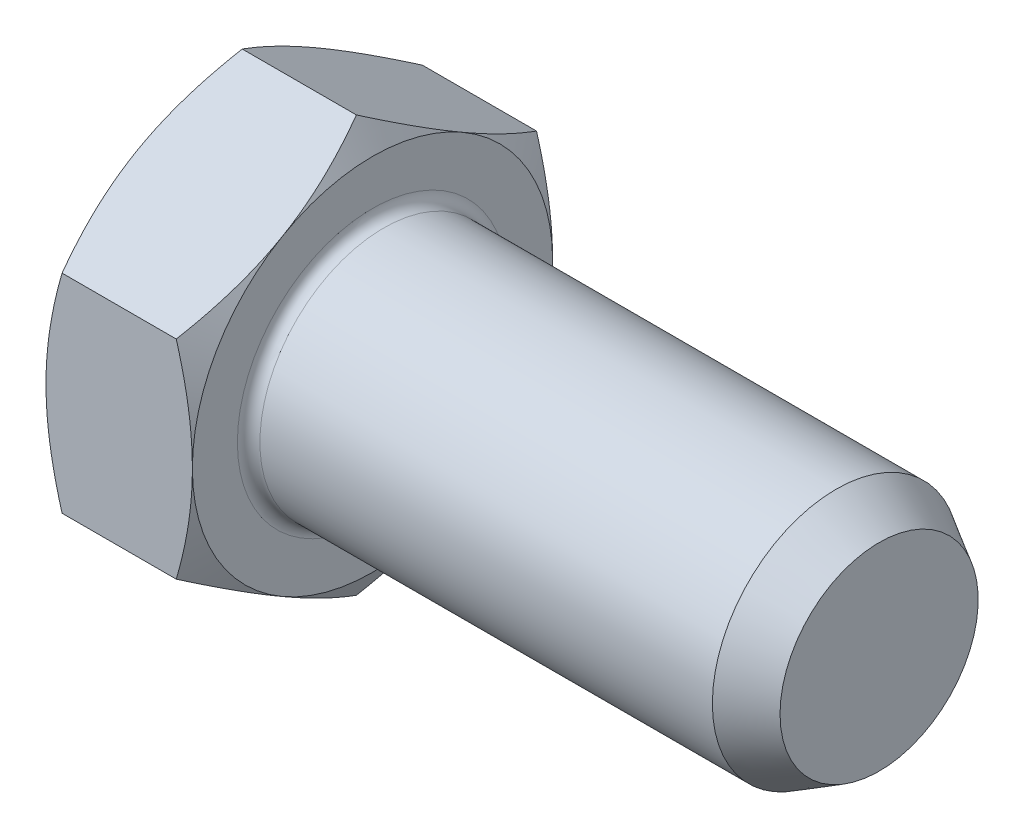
SolidWorks part; units mm, degrees
ref_plane "Front" through (0, 0, 0) normal (0, 0, 1) x (1, 0, 0)
ref_plane "Top" through (0, 0, 0) normal (0, 1, 0) x (1, 0, 0)
ref_plane "Right" through (0, 0, 0) normal (1, 0, 0) x (0, 0, -1)
sketch "Sketch1" plane through (0, 0, 0) normal (0, 0, 1) x (1, 0, 0)
  line L0 (0, 0) -> (0, 1.4)
  line L1 (0, 1.4) -> (1.3, 1.4)
  line L2 (1.3, 1.4) -> (1.3, 1.1)
  line L4 (1.3, 1.1) -> (5.8, 1.1)
  line L5 (5.8, 1.1) -> (5.8, 0)
  line L6 (5.8, 0) -> (0, 0)
  line L7 (13.1079, 0) -> (-2.2203, 0) construction
  dimension "da" = 2.8
  dimension "d" = 2.2
  dimension "k" = 1.3
  dimension "l" = 4.5
revolve "Revolve1" add sketch "Sketch1" angle 360 about L7
sketch "Sketch2" plane through (0, 0, 0) normal (-1, 0, 0) x (0, 0, 1)
  line L1 (1.6, -0.9238) -> (1.6, 0.9238)
  line L2 (1.6, 0.9238) -> (0, 1.8475)
  line L3 (0, 1.8475) -> (-1.6, 0.9238)
  line L4 (-1.6, 0.9238) -> (-1.6, -0.9238)
  line L5 (-1.6, -0.9238) -> (0, -1.8475)
  line L6 (0, -1.8475) -> (1.6, -0.9238)
  circle A0 centre (0, 0) radius 1.6 construction
  dimension "s" = 3.2
extrude "Extrude1" add sketch "Sketch2" against normal blind 1.3
sketch "Sketch3" plane through (0, 0, 0) normal (0, 1, 0) x (1, 0, 0)
  line L0 (-0.9238, 0) -> (0.65, 2.7258)
  line L1 (0.65, 2.7258) -> (1.3, 1.6)
  line L2 (0, 0) -> (-2.2444, 0) construction
  line L4 (1.3, 1.6) -> (1.3, 3.2258)
  line L5 (1.3, 3.2258) -> (-1.0238, 3.2258)
  line L6 (-0.9238, 0) -> (-1.0238, 0)
  line L7 (-1.0238, 0) -> (-1.0238, 3.2258)
  dimension "D1" = 60
  dimension "D2" = 0.5
  dimension "D3" = 0.1
  dimension "D4" = 60
revolve "Cut-Revolve2" cut sketch "Sketch3" angle 360 about L2
sketch "Sketch4" plane through (0, 0, 0) normal (0, 0, 1) x (1, 0, 0)
  line L0 (0, 0) -> (1.9538, 0) construction
  line L1 (-0.2, 0) -> (-0.2, 1.28)
  line L2 (-0.2, 1.28) -> (0.4, 1.28)
  line L3 (0.4, 1.28) -> (0.4, 0)
  line L4 (1.3, 1.4) -> (1.3, 1.1) construction
  line L5 (1.3, 1.4) -> (1.3, 1.8049) construction
  line L6 (0.4, 0) -> (-0.2, 0)
  dimension "D1" = 0.2
  dimension "D2" = 2.56
  dimension "k'" = 0.9
revolve "Cut-Revolve3" cut sketch "Sketch4" angle 360 about L0
chamfer "Chamfer1" distance 0.22 angle 60 1 edges at (5.8, 0, -1.1)
sketch "Sketch6" plane through (0, 0, 0) normal (0, 0, 1) x (1, 0, 0)
  line L0 (2.0155, 0.815) -> (1.5445, 0.815)
  line L1 (1.5445, 0.815) -> (1.38, 1.1)
  line L2 (2.0155, 0.815) -> (2.18, 1.1)
  line L3 (1.38, 1.1) -> (1.38, 1.35)
  line L4 (2.18, 1.1) -> (2.18, 1.35)
  line L5 (1.38, 1.35) -> (2.18, 1.35)
  line L6 (1.78, 0.815) -> (1.78, 0) construction
  line L7 (0, 0) -> (7.3035, 0) construction
  dimension "D1" = 2.2
  dimension "D2" = 60
  dimension "D3" = 0.25
  dimension "threadstart" = 1.78
  dimension "minordia" = 1.63
  dimension "advance" = 0.8
revolve "ThreadSchematic" [suppressed] cut sketch "Sketch6" angle 360 about L7
pattern_linear "ThdSchPat" [suppressed] count 6 spacing 0.8 along (-1, 0, 0)
sketch "Sketch5" plane through (0, 0, 0) normal (0, 0, 1) x (1, 0, 0)
  line L1 (5.8, 1.1) -> (5.8, 0) construction
  line L3 (3.5, -1.1) -> (4, -1.1) construction
  line L4 (0, 0) -> (6.648, 0) construction
  line L5 (5.8, 0) -> (4, -1.1)
  line L6 (5.8, 0) -> (6, 0)
  line L7 (6, 0) -> (6, -1.3)
  line L8 (6, -1.3) -> (4, -1.3)
  line L9 (4, -1.3) -> (4, -1.1)
  line L10 (4, -1.1) -> (6.8602, -1.1) construction
  dimension "D1" = 0.2
  dimension "y" = 2
  dimension "D3" = 0.2
  dimension "D4" = 2.2
revolve "EndCone" [suppressed] cut sketch "Sketch5" angle 360 about L4
fillet "Fillet1" radius 0.1 1 edges at (1.3, 0, -1.1)
equation "\"minordia@sketch6\" = \"D2@ThreadCosmetic\""
equation "\"D1@Extrude1\" = \"k@Sketch1\""
equation "\"D2@Sketch4\" = \"s@Sketch2\" * 4 / 5"
equation "\"D1@Chamfer1\" = \"d@Sketch1\" / 10"
equation "\"threadstart@Sketch6\" = \"D1@Extrude1\"+(\"advance@Sketch6\"*0.6)"
equation "\"D1@ThdSchPat\" = int((\"l@Sketch1\"/\"advance@Sketch6\") + 0.8)"
equation "\"D3@ThdSchPat\" = \"advance@Sketch6\""
equation "\"D1@Sketch6\" = \"d@Sketch1\""
equation "\"D4@Sketch5\" = \"d@Sketch1\""
